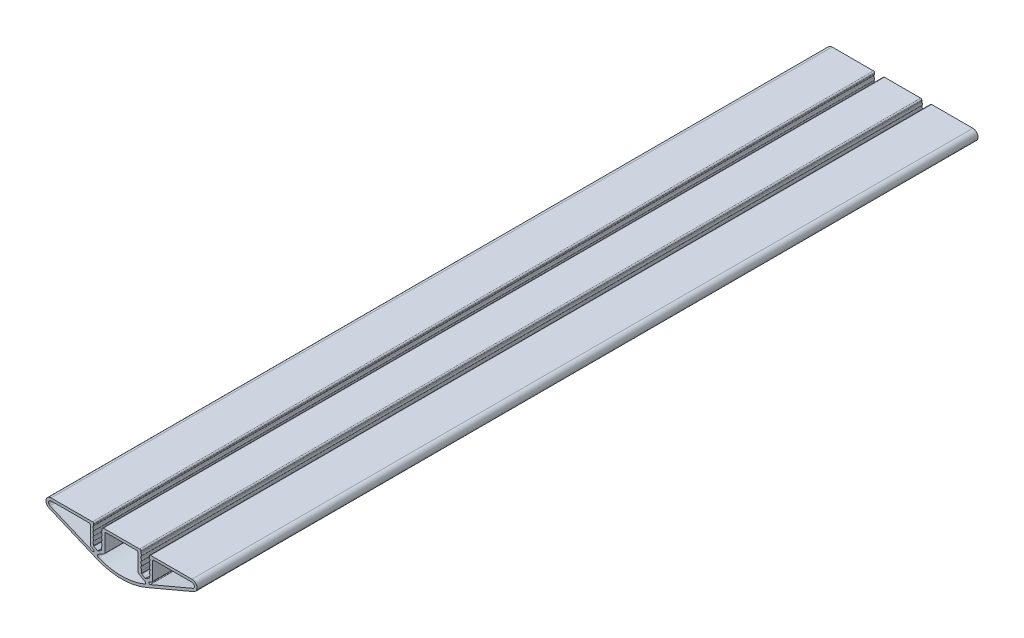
SolidWorks part; units mm, degrees
ref_plane "Спереди" through (0, 0, 0) normal (0, 0, 1) x (1, 0, 0)
ref_plane "Сверху" through (0, 0, 0) normal (0, 1, 0) x (1, 0, 0)
ref_plane "Справа" through (0, 0, 0) normal (1, 0, 0) x (0, 0, -1)
sketch "Model" plane through (0, 0, 0) normal (0, 0, 1) x (1, 0, 0)
  line L0 (453.8636, 2189.9931) -> (453.8636, 2196.623)
  line L1 (453.3636, 2197.123) -> (441.5776, 2197.123)
  line L2 (441.0776, 2196.623) -> (441.0776, 2189.9931)
  line L3 (440.9776, 2189.8199) -> (438.4342, 2188.3515)
  line L4 (456.5069, 2188.3515) -> (453.9636, 2189.8199)
  line L5 (474.5048, 2198.123) -> (458.6511, 2198.123)
  line L6 (458.1511, 2197.623) -> (458.1511, 2197.323)
  line L7 (458.1511, 2190.523) -> (458.1511, 2190.4045)
  line L8 (458.0511, 2190.2312) -> (456.6511, 2189.423)
  line L9 (456.6511, 2189.423) -> (455.2011, 2190.2601)
  line L10 (455.1511, 2190.3467) -> (455.1511, 2191.373)
  line L11 (454.9067, 2197.2633) -> (454.9067, 2197.623)
  line L12 (454.4067, 2198.123) -> (440.5345, 2198.123)
  line L13 (440.0345, 2197.623) -> (440.0345, 2197.2633)
  line L14 (439.79, 2191.373) -> (439.79, 2190.3467)
  line L15 (439.74, 2190.2601) -> (438.29, 2189.423)
  line L16 (438.29, 2189.423) -> (436.89, 2190.2312)
  line L17 (436.79, 2190.4045) -> (436.79, 2190.523)
  line L18 (436.79, 2197.323) -> (436.79, 2197.623)
  line L19 (436.29, 2198.123) -> (420.4363, 2198.123)
  line L20 (419.6693, 2194.3473) -> (437.9177, 2186.6133)
  line L21 (457.0234, 2186.6133) -> (475.2719, 2194.3473)
  line L22 (436.6944, 2189.0831) -> (435.6747, 2189.5629)
  line L23 (435.5024, 2189.8343) -> (435.5024, 2196.623)
  line L24 (435.0024, 2197.123) -> (420.4363, 2197.123)
  line L25 (420.0595, 2195.268) -> (436.4375, 2188.3307)
  line L26 (458.5232, 2188.335) -> (474.8817, 2195.268)
  line L27 (474.5048, 2197.123) -> (459.9387, 2197.123)
  line L28 (459.4387, 2196.623) -> (459.4387, 2189.8343)
  line L29 (459.2664, 2189.5629) -> (458.2468, 2189.0831)
  line L30 (458.5036, 2188.3307) -> (458.5232, 2188.335)
  arc A0 (453.8636, 2196.623) -> (453.3636, 2197.123) centre (453.3636, 2196.623) ccw
  arc A1 (441.5776, 2197.123) -> (441.0776, 2196.623) centre (441.5776, 2196.623) ccw
  arc A2 (440.9776, 2189.8199) -> (441.0776, 2189.9931) centre (440.8776, 2189.9931) ccw
  arc A3 (438.4342, 2188.3515) -> (438.4931, 2187.4565) centre (438.6842, 2187.9185) ccw
  arc A4 (438.4931, 2187.4565) -> (456.4481, 2187.4565) centre (447.4706, 2209.1534) ccw
  arc A5 (456.4481, 2187.4565) -> (456.5069, 2188.3515) centre (456.2569, 2187.9185) ccw
  arc A6 (453.8636, 2189.9931) -> (453.9636, 2189.8199) centre (454.0636, 2189.9931) ccw
  arc A7 (475.2719, 2194.3473) -> (474.5048, 2198.123) centre (474.5048, 2196.1572) ccw
  arc A8 (458.6511, 2198.123) -> (458.1511, 2197.623) centre (458.6511, 2197.623) ccw
  arc A9 (458.1511, 2197.323) -> (458.3155, 2196.8372) centre (458.9511, 2197.323) ccw
  arc A10 (458.3155, 2196.1087) -> (458.3155, 2196.8372) centre (457.8387, 2196.473) ccw
  arc A11 (458.3155, 2196.1087) -> (458.3155, 2195.1372) centre (458.9511, 2195.623) ccw
  arc A12 (458.3155, 2194.4087) -> (458.3155, 2195.1372) centre (457.8387, 2194.773) ccw
  arc A13 (458.3155, 2194.4087) -> (458.3155, 2193.4372) centre (458.9511, 2193.923) ccw
  arc A14 (458.3155, 2192.7087) -> (458.3155, 2193.4372) centre (457.8387, 2193.073) ccw
  arc A15 (458.3155, 2192.7087) -> (458.3155, 2191.7372) centre (458.9511, 2192.223) ccw
  arc A16 (458.3155, 2191.0087) -> (458.3155, 2191.7372) centre (457.8387, 2191.373) ccw
  arc A17 (458.3155, 2191.0087) -> (458.1511, 2190.523) centre (458.9511, 2190.523) ccw
  arc A18 (458.0511, 2190.2312) -> (458.1511, 2190.4045) centre (457.9511, 2190.4045) ccw
  arc A19 (455.1511, 2190.3467) -> (455.2011, 2190.2601) centre (455.2511, 2190.3467) ccw
  arc A20 (455.1511, 2191.373) -> (454.9868, 2191.8587) centre (454.3511, 2191.373) ccw
  arc A21 (454.9868, 2192.5872) -> (454.9868, 2191.8587) centre (455.4636, 2192.223) ccw
  arc A22 (454.9868, 2192.5872) -> (454.9868, 2193.5587) centre (454.3511, 2193.073) ccw
  arc A23 (454.9868, 2194.2872) -> (454.9868, 2193.5587) centre (455.4636, 2193.923) ccw
  arc A24 (454.9868, 2194.2872) -> (454.9868, 2195.2587) centre (454.3511, 2194.773) ccw
  arc A25 (454.9868, 2195.9872) -> (454.9868, 2195.2587) centre (455.4636, 2195.623) ccw
  arc A26 (454.9868, 2195.9872) -> (455.0114, 2196.9246) centre (454.3511, 2196.473) ccw
  arc A27 (454.9067, 2197.2633) -> (455.0114, 2196.9246) centre (455.5067, 2197.2633) ccw
  arc A28 (454.9067, 2197.623) -> (454.4067, 2198.123) centre (454.4067, 2197.623) ccw
  arc A29 (440.5345, 2198.123) -> (440.0345, 2197.623) centre (440.5345, 2197.623) ccw
  arc A30 (439.9297, 2196.9246) -> (440.0345, 2197.2633) centre (439.4345, 2197.2633) ccw
  arc A31 (439.9297, 2196.9246) -> (439.9543, 2195.9872) centre (440.59, 2196.473) ccw
  arc A32 (439.9543, 2195.2587) -> (439.9543, 2195.9872) centre (439.4776, 2195.623) ccw
  arc A33 (439.9543, 2195.2587) -> (439.9543, 2194.2872) centre (440.59, 2194.773) ccw
  arc A34 (439.9543, 2193.5587) -> (439.9543, 2194.2872) centre (439.4776, 2193.923) ccw
  arc A35 (439.9543, 2193.5587) -> (439.9543, 2192.5872) centre (440.59, 2193.073) ccw
  arc A36 (439.9543, 2191.8587) -> (439.9543, 2192.5872) centre (439.4776, 2192.223) ccw
  arc A37 (439.9543, 2191.8587) -> (439.79, 2191.373) centre (440.59, 2191.373) ccw
  arc A38 (439.74, 2190.2601) -> (439.79, 2190.3467) centre (439.69, 2190.3467) ccw
  arc A39 (436.79, 2190.4045) -> (436.89, 2190.2312) centre (436.99, 2190.4045) ccw
  arc A40 (436.79, 2190.523) -> (436.6257, 2191.0087) centre (435.99, 2190.523) ccw
  arc A41 (436.6257, 2191.7372) -> (436.6257, 2191.0087) centre (437.1024, 2191.373) ccw
  arc A42 (436.6257, 2191.7372) -> (436.6257, 2192.7087) centre (435.99, 2192.223) ccw
  arc A43 (436.6257, 2193.4372) -> (436.6257, 2192.7087) centre (437.1024, 2193.073) ccw
  arc A44 (436.6257, 2193.4372) -> (436.6257, 2194.4087) centre (435.99, 2193.923) ccw
  arc A45 (436.6257, 2195.1372) -> (436.6257, 2194.4087) centre (437.1024, 2194.773) ccw
  arc A46 (436.6257, 2195.1372) -> (436.6257, 2196.1087) centre (435.99, 2195.623) ccw
  arc A47 (436.6257, 2196.8372) -> (436.6257, 2196.1087) centre (437.1024, 2196.473) ccw
  arc A48 (436.6257, 2196.8372) -> (436.79, 2197.323) centre (435.99, 2197.323) ccw
  arc A49 (436.79, 2197.623) -> (436.29, 2198.123) centre (436.29, 2197.623) ccw
  arc A50 (420.4363, 2198.123) -> (419.6693, 2194.3473) centre (420.4363, 2196.1572) ccw
  arc A51 (437.9177, 2186.6133) -> (457.0234, 2186.6133) centre (447.4706, 2209.1534) ccw
  arc A52 (436.4375, 2188.3307) -> (436.6944, 2189.0831) centre (436.5241, 2188.7212) ccw
  arc A53 (435.5024, 2189.8343) -> (435.6747, 2189.5629) centre (435.8024, 2189.8343) ccw
  arc A54 (435.5024, 2196.623) -> (435.0024, 2197.123) centre (435.0024, 2196.623) ccw
  arc A55 (420.4363, 2197.123) -> (420.0595, 2195.268) centre (420.4363, 2196.1572) ccw
  arc A56 (474.8817, 2195.268) -> (474.5048, 2197.123) centre (474.5048, 2196.1572) ccw
  arc A57 (459.9387, 2197.123) -> (459.4387, 2196.623) centre (459.9387, 2196.623) ccw
  arc A58 (459.2664, 2189.5629) -> (459.4387, 2189.8343) centre (459.1387, 2189.8343) ccw
  arc A59 (458.2468, 2189.0831) -> (458.5036, 2188.3307) centre (458.4171, 2188.7212) ccw
extrude "Бобышка-Вытянуть1" add sketch "Model" along normal blind 300
